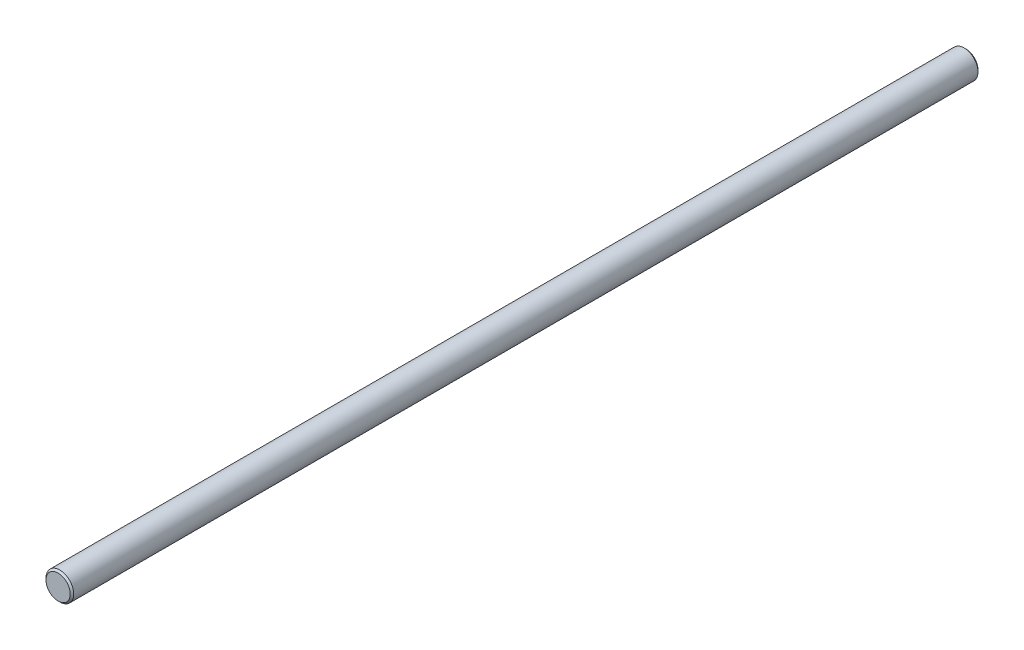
SolidWorks part; units mm, degrees
ref_plane "Спереди" through (0, 0, 0) normal (0, 0, 1) x (1, 0, 0)
ref_plane "Сверху" through (0, 0, 0) normal (0, 1, 0) x (1, 0, 0)
ref_plane "Справа" through (0, 0, 0) normal (1, 0, 0) x (0, 0, -1)
ref_plane "Плоскость4" through (0, 0, -267) normal (0, 0, -1) x (-1, 0, 0)
sketch "Эскиз1" plane through (0, 0, -267) normal (0, 0, -1) x (-1, 0, 0)
  circle A0 centre (0, 0) radius 4
  dimension "D1" = 8
extrude "Бобышка-Вытянуть1" add sketch "Эскиз1" against normal blind 262
chamfer "Фаска1" distance 0.5 angle 45 2 edges at (4, 0, -5) (4, 0, -267)
